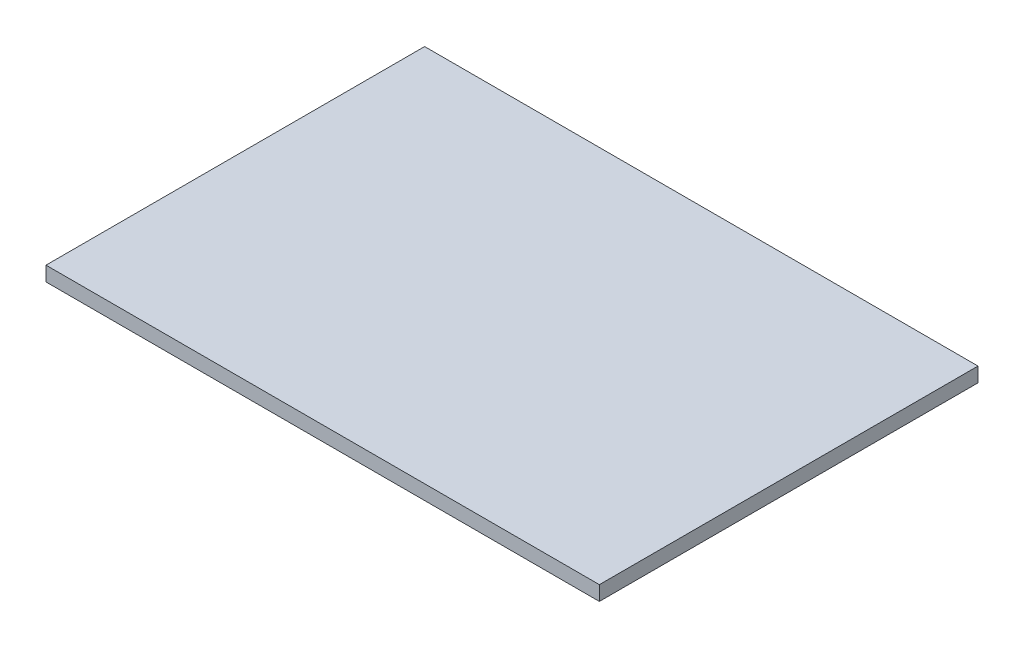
SolidWorks part; units mm, degrees
ref_plane "前视基准面" through (0, 0, 0) normal (0, 0, 1) x (1, 0, 0)
ref_plane "上视基准面" through (0, 0, 0) normal (0, 1, 0) x (1, 0, 0)
ref_plane "右视基准面" through (0, 0, 0) normal (1, 0, 0) x (0, 0, -1)
other "Configuration Table"
sketch "草图1" plane through (0, 0, 0) normal (0, 1, 0) x (1, 0, 0)
  line L1 (95, -65) -> (-95, -65)
  line L2 (95, -65) -> (95, 65)
  line L3 (95, 65) -> (-95, 65)
  line L4 (-95, -65) -> (-95, 65)
  line L5 (95, -65) -> (-95, 65) construction
  line L6 (95, 65) -> (-95, -65) construction
  point P0 (0, 0)
  dimension "D1" = 190
  dimension "D2" = 130
extrude "凸台-拉伸1" add sketch "草图1" along normal blind 5
